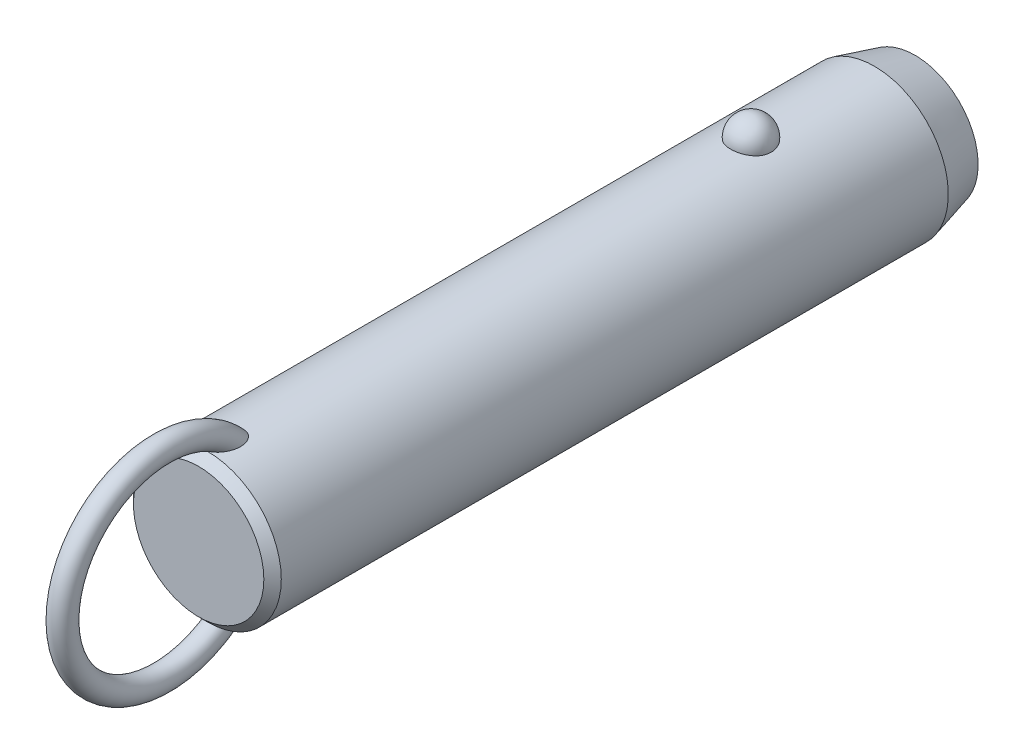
SolidWorks part; units mm, degrees
ref_plane "Front Plane" through (0, 0, 0) normal (0, 0, 1) x (1, 0, 0)
ref_plane "Top Plane" through (0, 0, 0) normal (0, 1, 0) x (1, 0, 0)
ref_plane "Right Plane" through (0, 0, 0) normal (1, 0, 0) x (0, 0, -1)
sketch "Sketch2" plane through (0, 0, 0) normal (0, 0, 1) x (1, 0, 0)
  circle A0 centre (0, 0) radius 12.7
  point P3 (0, 12.7)
  dimension "D1" = 25.4
extrude "Boss-Extrude1" add sketch "Sketch2" along normal blind 78.7
sketch "Sketch3" plane through (0, 0, 0) normal (0, 0, -1) x (-1, 0, 0)
  circle A0 centre (0, 0) radius 12.7
  dimension "D1" = 25.4
extrude "Boss-Extrude2" add sketch "Sketch3" along normal blind 31.7
chamfer "Chamfer1" distance 7 angle 15 1 edges at (-12.7, 0, -31.7)
sketch "Sketch12" plane through (0, 0, 0) normal (1, 0, 0) x (0, 0, -1)
  line L0 (-78.7, 12.7) -> (-78.7, -12.7) construction
  point P0 (-78.7, 0)
sketch "Sketch13" plane through (0, 0, 0) normal (1, 0, 0) x (0, 0, -1)
  circle A0 centre (-97.75, 0) radius 19.05
  point P2 (-78.7, 0)
  dimension "D1" = 38.1
sketch "Sketch14" plane through (0, 0, 0) normal (0, 1, 0) x (1, 0, 0)
  circle A0 centre (0, -80.7) radius 2
  point P2 (0, -78.7)
  dimension "D1" = 4
sweep "Sweep1" add profiles "Sketch14" path "Sketch13"
sketch "Sketch15" plane through (0, 0, 78.7) normal (0, 0, 1) x (1, 0, 0)
  circle A0 centre (0, 0) radius 12.7
  dimension "D1" = 25.4
extrude "Boss-Extrude3" add sketch "Sketch15" along normal blind 12.7
chamfer "Chamfer2" distance 1.5 angle 45 1 edges at (12.7, 0, 91.4)
sketch "Sketch18" plane through (0, 0, 0) normal (1, 0, 0) x (0, 0, -1)
  line L0 (24.7, 12.7) -> (-83.551, 12.7) construction
  line L1 (3.5, 16.2) -> (3.5, 9.2)
  line L2 (-83.551, -12.7) -> (24.7, -12.7) construction
  arc A0 (3.5, 16.2) -> (3.5, 9.2) centre (3.5, 12.7) ccw
  point P4 (0, 12.7)
  dimension "D1" = 28.9
revolve "Revolve1" add sketch "Sketch18" angle 360 about L1
